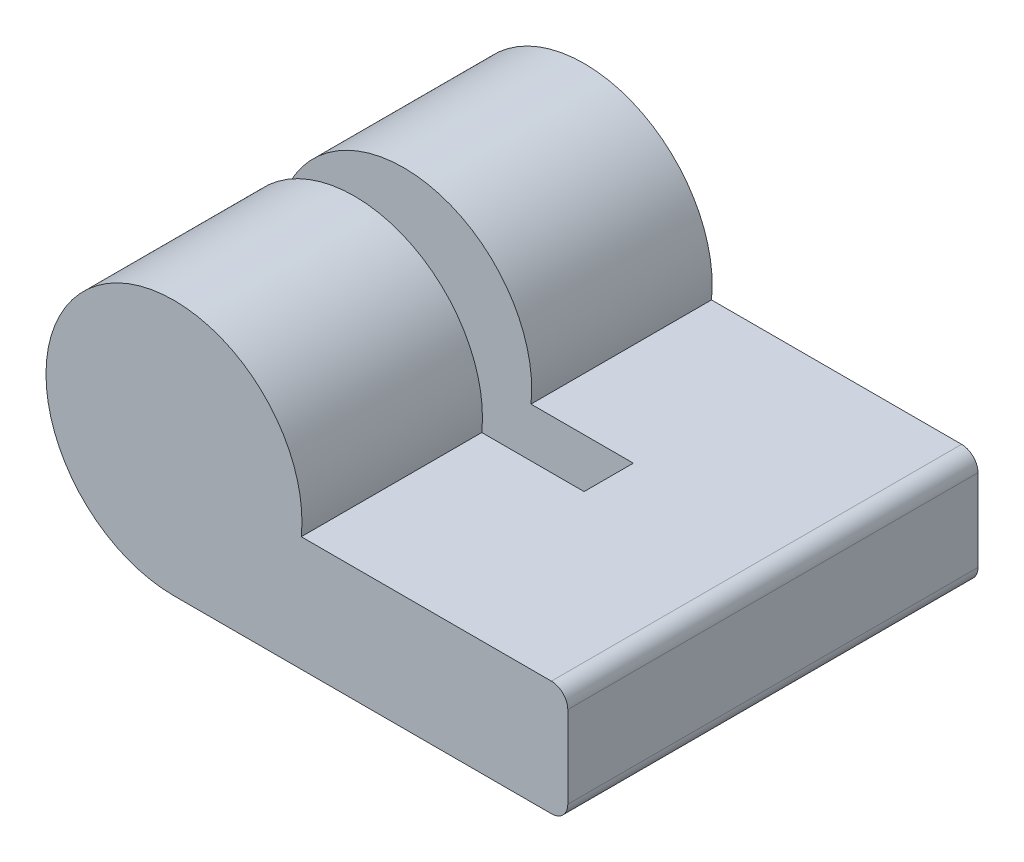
SolidWorks part; units mm, degrees
ref_plane "Plan1" through (0, 0, 0) normal (0, 0, 1) x (1, 0, 0)
ref_plane "Plan2" through (0, 0, 0) normal (0, 1, 0) x (1, 0, 0)
ref_plane "Plan3" through (0, 0, 0) normal (1, 0, 0) x (0, 0, -1)
sketch "Esquisse1" plane through (0, 0, 0) normal (0, 0, 1) x (1, 0, 0)
  line L0 (0, -3.9) -> (12, -3.9)
  line L1 (12, -3.9) -> (12, -0.4)
  line L2 (12, -0.4) -> (3.8794, -0.4)
  arc A0 (3.8794, -0.4) -> (0, -3.9) centre (0, 0) ccw
  dimension "D1" = 7.8
  dimension "D2" = 12
  dimension "D3" = 3.5
extrude "Base-Extrusion" add sketch "Esquisse1" along normal blind 12.5
fillet "Congé1" radius 0.5 2 edges at (12, -0.4, 6.25) (12, -3.9, 6.25)
ref_plane "Plan4" through (0, 0, 7) normal (0, 0, 1) x (1, 0, 0)
sketch "Esquisse2" plane through (0, 0, 7) normal (0, 0, 1) x (1, 0, 0)
  circle A0 centre (-15, 20) radius 30
  dimension "D1" = 60
  dimension "D2" = 20
  dimension "D3" = 15
extrude "Enlèv. mat.-Extru.1" cut sketch "Esquisse2" against normal blind 1.5
